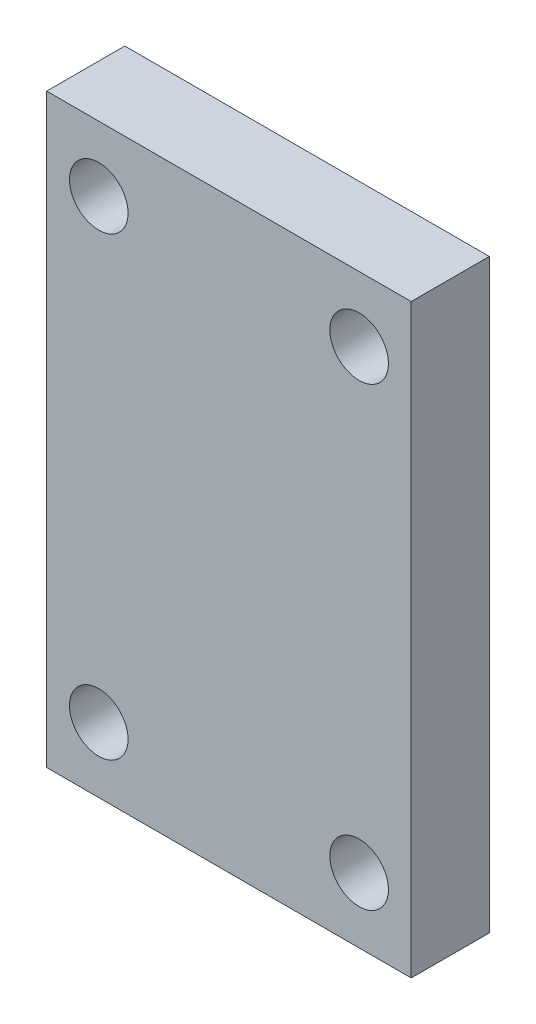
SolidWorks part; units mm, degrees
ref_plane "前视基准面" through (0, 0, 0) normal (0, 0, 1) x (1, 0, 0)
ref_plane "上视基准面" through (0, 0, 0) normal (0, 1, 0) x (1, 0, 0)
ref_plane "右视基准面" through (0, 0, 0) normal (1, 0, 0) x (0, 0, -1)
sketch "草图1" plane through (0, 0, 0) normal (0, 0, 1) x (1, 0, 0)
  line L0 (0, -45) -> (28, -45)
  line L1 (0, 0) -> (28, 0)
  line L2 (0, -45) -> (0, 0)
  line L3 (28, -45) -> (28, 0)
  circle A0 centre (24, -5) radius 2.25
  circle A1 centre (4, -5) radius 2.25
  circle A2 centre (4, -40) radius 2.25
  circle A3 centre (24, -40) radius 2.25
extrude "凸台-拉伸1" add sketch "草图1" along normal blind 6
